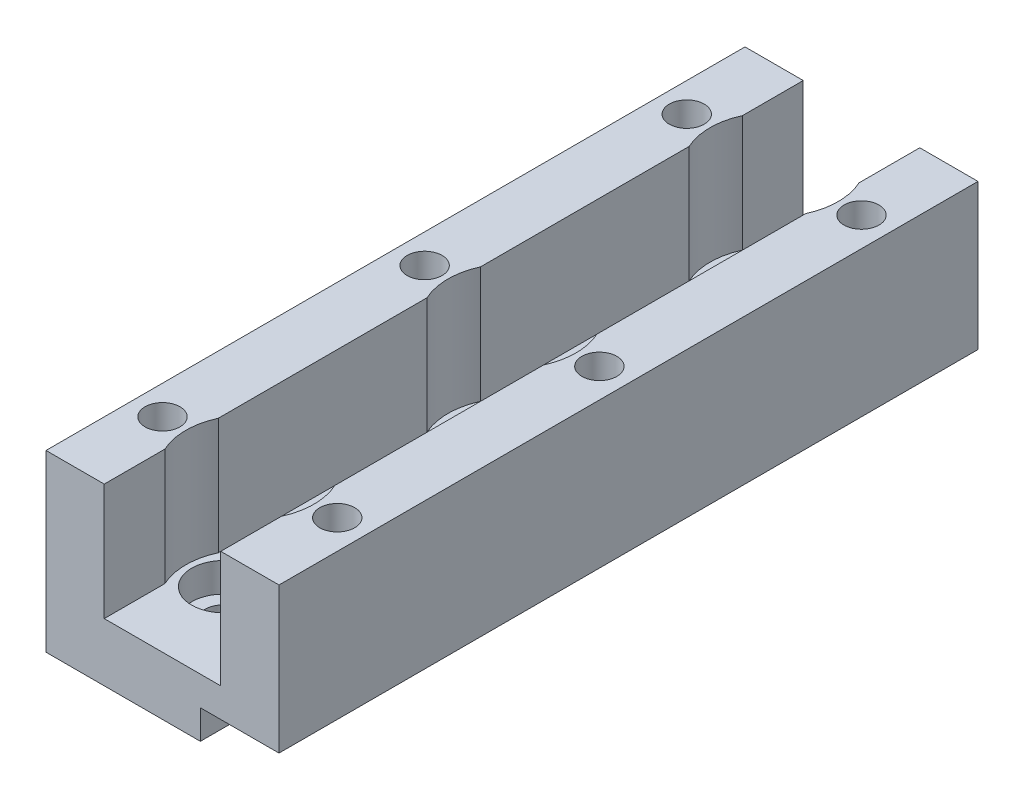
SolidWorks part; units mm, degrees
ref_plane "Face" through (0, 0, 0) normal (0, 0, 1) x (1, 0, 0)
ref_plane "Dessus" through (0, 0, 0) normal (0, 1, 0) x (1, 0, 0)
ref_plane "Droite" through (0, 0, 0) normal (1, 0, 0) x (0, 0, -1)
sketch "Esquisse1" plane through (0, 0, 0) normal (0, 0, 1) x (1, 0, 0)
  line L0 (0, 0) -> (-26.5, 0)
  line L1 (-26.5, 0) -> (-26.5, 30)
  line L2 (-26.5, 30) -> (-16.5, 30)
  line L3 (-16.5, 30) -> (-16.5, 10)
  line L4 (-16.5, 10) -> (3.5, 10)
  line L5 (3.5, 10) -> (3.5, 30)
  line L6 (3.5, 30) -> (13.5, 30)
  line L7 (13.5, 30) -> (13.5, 5)
  line L8 (13.5, 5) -> (0, 5)
  line L9 (0, 5) -> (0, 0)
  dimension "D1" = 20
  dimension "D2" = 30
  dimension "D3" = 20
  dimension "D4" = 5
  dimension "D5" = 10
  dimension "D6" = 13.5
  dimension "D7" = 40
extrude "Extrusion1" add sketch "Esquisse1" along normal blind 120
sketch "Esquisse2" plane through (0, 30, 0) normal (0, 1, 0) x (-1, 0, 0)
  line L0 (-13.5, 0) -> (-3.5, 0) construction
  line L1 (-13.5, 120) -> (-13.5, 0) construction
  circle A0 centre (-8.5, 15) radius 3
  dimension "D1" = 15
  dimension "D2" = 6
  dimension "D3" = 5
extrude "Enlèv. mat.-Extru.1" cut sketch "Esquisse2" against normal up to next
pattern_linear "Répétition linéaire1" count 3 spacing 45 along (0, 0, 1) count 2 spacing 30 along (-1, 0, 0) of "Enlèv. mat.-Extru.1"
sketch "Esquisse3" plane through (0, 10, 0) normal (0, 1, 0) x (-1, 0, 0)
  line L0 (-3.5, 120) -> (16.5, 120) construction
  circle A0 centre (11, 105) radius 3.25
  dimension "D2" = 6.5
  dimension "D3" = 15
  dimension "D1" = 15.5
extrude "Enlèv. mat.-Extru.2" cut sketch "Esquisse3" against normal up to next
sketch "Esquisse4" plane through (0, 10, 0) normal (0, 1, 0) x (-1, 0, 0)
  circle A0 centre (11, 105) radius 5.5
  dimension "D1" = 11
extrude "Enlèv. mat.-Extru.3" cut sketch "Esquisse4" against normal blind 5
sketch "Esquisse5" plane through (0, 30, 0) normal (0, 1, 0) x (-1, 0, 0)
  line L0 (6.5, 120) -> (6.5, 86.224) construction
  line L1 (-3.5, 120) -> (16.5, 120) construction
  line L3 (11, 105) -> (-1.9052, 105) construction
  circle A0 centre (6.5, 105) radius 11
  dimension "D1" = 22
extrude "Enlèv. mat.-Extru.4" cut sketch "Esquisse5" against normal up to surface (20 mm away)
pattern_linear "Répétition linéaire2" count 3 spacing 45 along (0, 0, -1) of "Enlèv. mat.-Extru.4", "Enlèv. mat.-Extru.3", "Enlèv. mat.-Extru.2"
